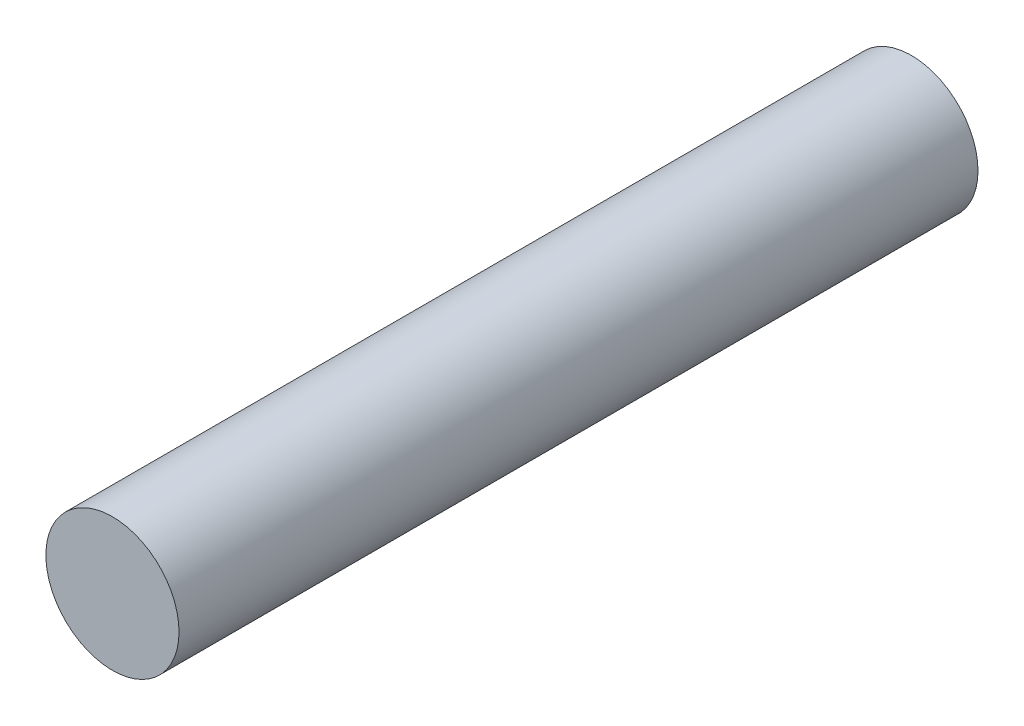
SolidWorks part; units mm, degrees
ref_plane "Plan de face" through (0, 0, 0) normal (0, 0, 1) x (1, 0, 0)
ref_plane "Plan de dessus" through (0, 0, 0) normal (0, 1, 0) x (1, 0, 0)
ref_plane "Plan de droite" through (0, 0, 0) normal (1, 0, 0) x (0, 0, -1)
sketch "Esquisse1" plane through (0, 0, 0) normal (0, 0, 1) x (1, 0, 0)
  circle A0 centre (0, 0) radius 2.5
  dimension "D1" = 5
extrude "Boss.-Extru.1" add sketch "Esquisse1" along normal blind 30
